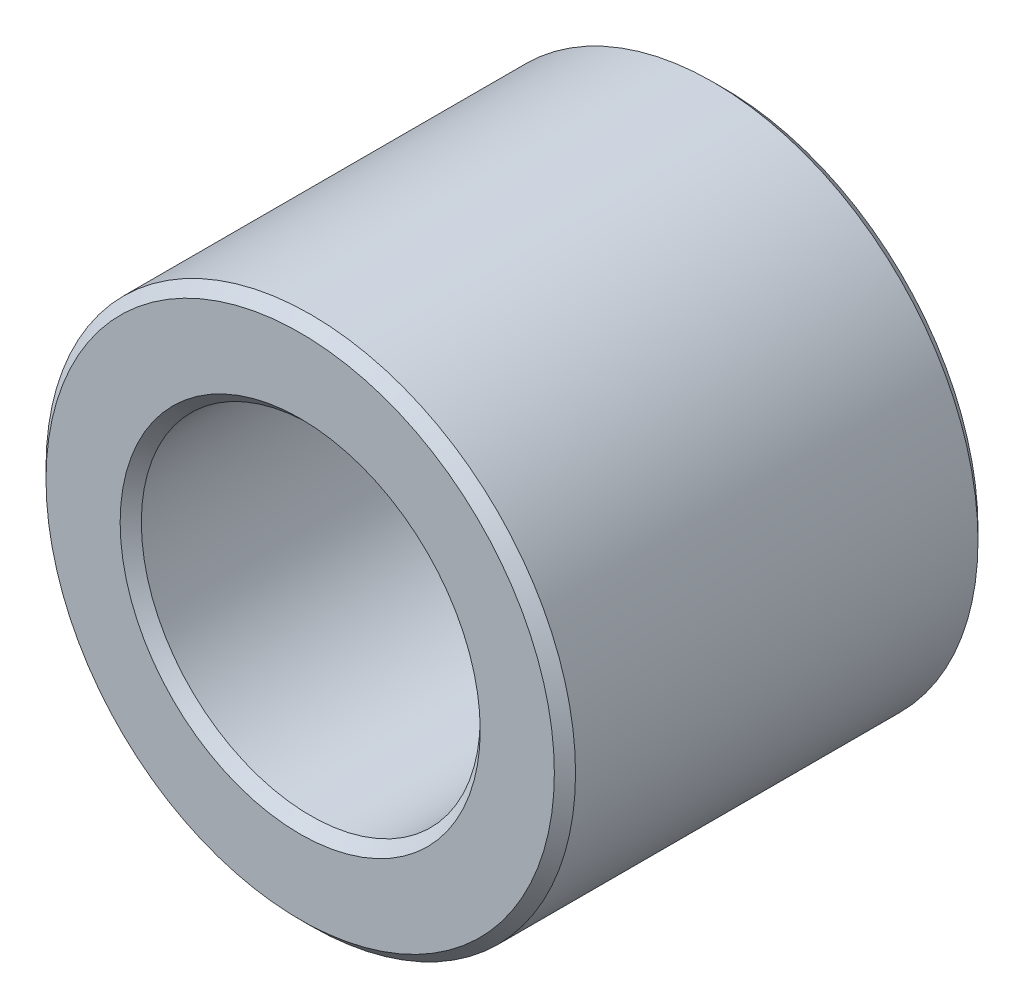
SolidWorks part; units mm, degrees
ref_plane "Front Plane" through (0, 0, 0) normal (0, 0, 1) x (1, 0, 0)
ref_plane "Top Plane" through (0, 0, 0) normal (0, 1, 0) x (1, 0, 0)
ref_plane "Right Plane" through (0, 0, 0) normal (1, 0, 0) x (0, 0, -1)
sketch "Sketch1" plane through (0, 0, 0) normal (0, 0, 1) x (1, 0, 0)
  circle A0 centre (0, 0) radius 5
  circle A1 centre (0, 0) radius 3.2
  dimension "D1" = 10
  dimension "D2" = 6.4
extrude "Boss-Extrude2" add sketch "Sketch1" along normal mid plane 8
chamfer "Chamfer3" distance 0.2 angle 45 4 edges at (5, 0, 4) (5, 0, -4) (3.2, 0, -4) (3.2, 0, 4)
